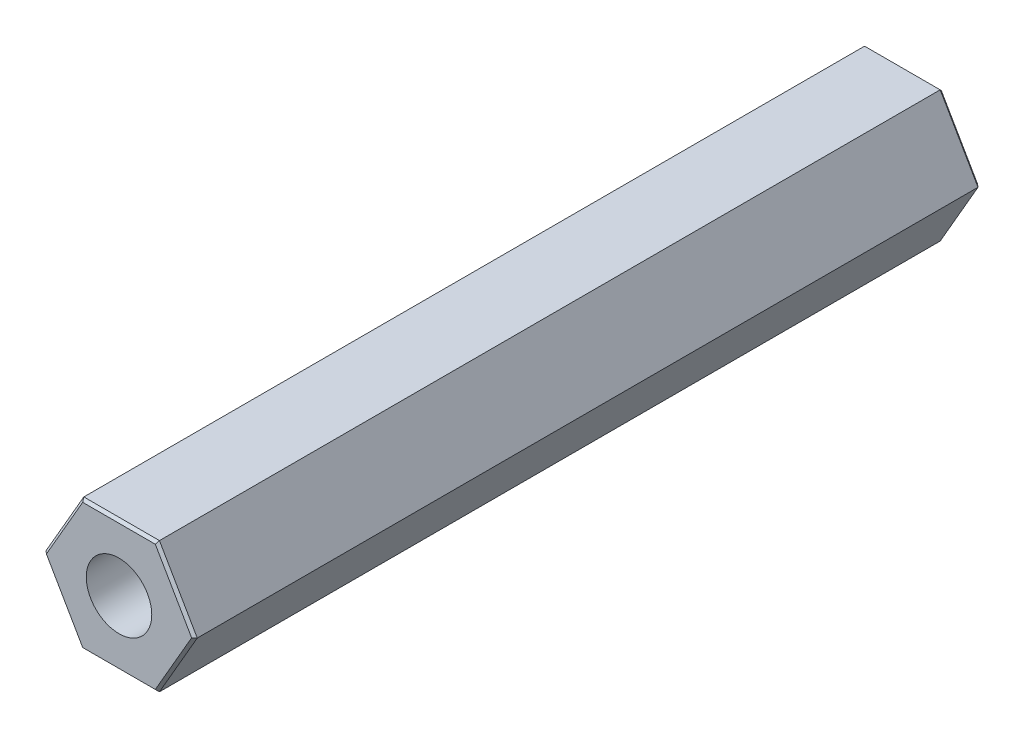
SolidWorks part; units mm, degrees
ref_plane "Přední" through (0, 0, 0) normal (0, 0, 1) x (1, 0, 0)
ref_plane "Horní" through (0, 0, 0) normal (0, 1, 0) x (1, 0, 0)
ref_plane "Pravá" through (0, 0, 0) normal (1, 0, 0) x (0, 0, -1)
sketch "Skica1" plane through (0, 0, 0) normal (0, 0, 1) x (1, 0, 0)
  line L0 (0, 0) -> (1.5092, 0) construction
  line L1 (1.4434, 2.5) -> (-1.4434, 2.5)
  line L2 (-1.4434, 2.5) -> (-2.8868, 0)
  line L3 (-2.8868, 0) -> (-1.4434, -2.5)
  line L4 (-1.4434, -2.5) -> (1.4434, -2.5)
  line L5 (1.4434, -2.5) -> (2.8868, 0)
  line L6 (2.8868, 0) -> (1.4434, 2.5)
  circle A0 centre (0, 0) radius 2.5 construction
  dimension "D1" = 5
extrude "Přidat vysunutím1" add sketch "Skica1" along normal blind 30
chamfer "Zkosení1" distance 0.1 angle 45 12 edges at (2.1651, 1.25, 0) (2.1651, -1.25, 0) (0, -2.5, 0) (-2.1651, -1.25, 0) (-2.1651, 1.25, 0) (0, 2.5, 0) (-2.1651, 1.25, 30) (-2.1651, -1.25, 30) (0, -2.5, 30) (2.1651, -1.25, 30) (2.1651, 1.25, 30) (0, 2.5, 30)
sketch "Skica2" plane through (0, 0, 0) normal (0, 0, -1) x (-1, 0, 0)
  circle A0 centre (0, 0) radius 1.25
  dimension "D1" = 2.5
extrude "Odebrat vysunutím1" cut sketch "Skica2" against normal blind 12
sketch "Skica3" plane through (0, 0, 30) normal (0, 0, 1) x (1, 0, 0)
  circle A0 centre (0, 0) radius 1.25
  dimension "D1" = 2.5
extrude "Odebrat vysunutím2" cut sketch "Skica3" against normal blind 12
chamfer "Zkosení2" distance 1.25 angle 45 2 edges at (-1.25, 0, 12) (1.25, 0, 18)
